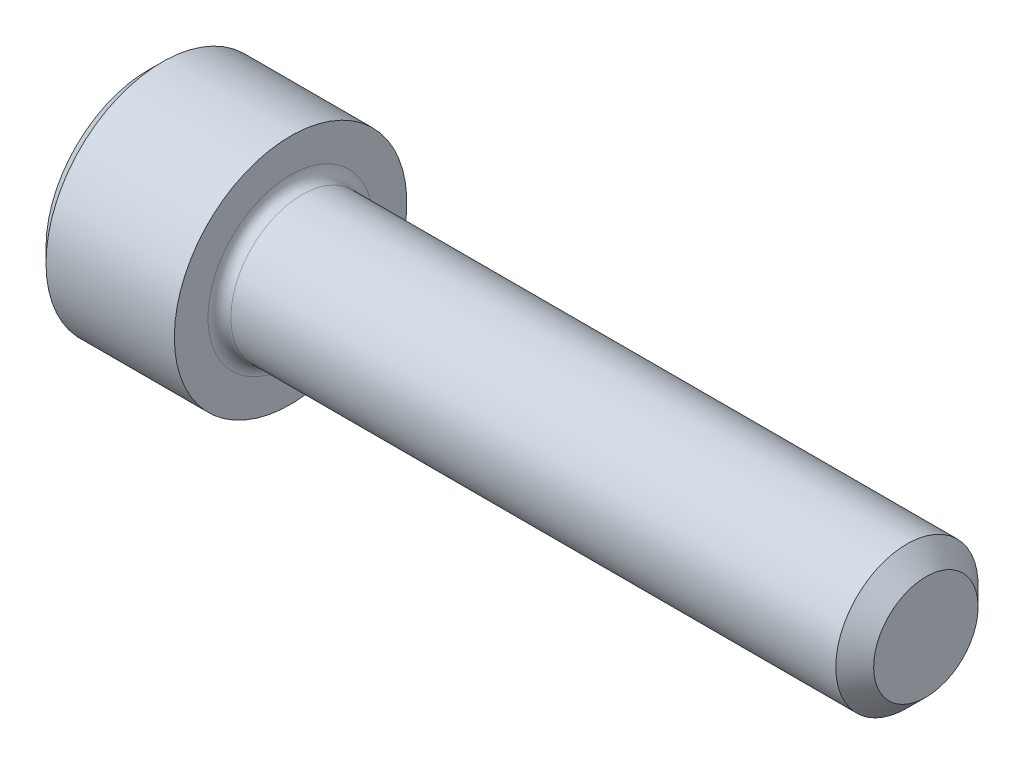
SolidWorks part; units mm, degrees
revolve "Base-Revolve" add sketch "BodySke"
sketch "BodySke" plane through (0, 0, 0) normal (0, 0, 1) x (1, 0, 0)
  line L0 (0, 0) -> (0, 2.0447)
  line L1 (0.2794, 2.3241) -> (2.8448, 2.3241)
  line L2 (2.8448, 2.3241) -> (2.8448, 1.4224)
  line L3 (2.8448, 1.4224) -> (15.1663, 1.4224)
  line L4 (15.5448, 1.0439) -> (15.5448, 0)
  line L5 (15.5448, 0) -> (0, 0)
  line L6 (-31.75, 0) -> (127, 0) construction
  line L7 (0, 2.0447) -> (0.2794, 2.3241)
  line L8 (15.5448, 1.0439) -> (15.1663, 1.4224)
  line L9 (0, -2.0447) -> (0.2794, -2.3241) construction
  line L10 (15.5448, -1.0439) -> (15.1663, -1.4224) construction
  line L11 (3.4798, 9.525) -> (3.4798, 3.175) construction
  line L12 (2.8448, 9.525) -> (2.8448, 3.175) construction
  line L13 (-22.5552, 9.525) -> (-22.5552, 3.175) construction
  dimension "Diameter" = 2.8448
  dimension "Head_ht" = 2.8448
  dimension "Length" = 12.7
  dimension "Body_ch_ang" = 45
  dimension "Head_dia" = 4.6482
  dimension "Head_ch_ang" = 45
  dimension "Head_side_ht" = 2.5654
  dimension "Minor_dia" = 2.0879
  dimension "Advance" = 0.635
  dimension "Thread_nom" = 12.7
  dimension "Thread_length" = 38.1
fillet "Fillet1" radius 0.2286 1 edges at (2.8448, 0, 1.4224)
ref_plane "Plane1" through (0, 0, 0) normal (0, 0, 1) x (1, 0, 0)
ref_plane "Plane2" through (0, 0, 0) normal (0, 1, 0) x (1, 0, 0)
ref_plane "Plane3" through (0, 0, 0) normal (1, 0, 0) x (0, 0, -1)
sketch "Sketch2" plane through (0, 0, 0) normal (0, 0, 1) x (1, 0, 0)
  line L0 (0, 1.1938) -> (1.2954, 1.1938)
  line L1 (1.2954, 1.1938) -> (1.9846, 0)
  line L2 (-31.75, 0) -> (127, 0) construction
  line L3 (1.9846, 0) -> (0, 0)
  line L4 (0, 0) -> (0, 1.1938)
  line L5 (0, 2.0447) -> (0, -2.0447) construction
  line L6 (0, 0) -> (47.625, 0) construction
  line L7 (2.8448, -2.3241) -> (2.8448, 2.3241) construction
revolve "Hex-PreBroach" cut sketch "Sketch2" angle 360 about L6
sketch "Sketch3" plane through (0, 0, 0) normal (-1, 0, 0) x (0, 0.5, 0.866)
  line L0 (0.6892, 1.1938) -> (-0.6892, 1.1938)
  line L1 (-0.6892, 1.1938) -> (-1.3785, 0)
  line L2 (0.6892, 1.1938) -> (1.3785, 0)
  line L3 (0.6892, -1.1938) -> (1.3785, 0)
  line L4 (0.6892, -1.1938) -> (-0.6892, -1.1938)
  line L5 (-0.6892, -1.1938) -> (-1.3785, 0)
extrude "Hex" cut sketch "Sketch3" against normal blind 1.2954
sketch "Sketch4" plane through (0, 0, 0) normal (-1, 0, 0) x (0, 0, 1)
  line L0 (0, 0) -> (1.4605, 0)
  line L1 (0, 0) -> (6.1484, 3.5498) construction
  line L2 (0, 0) -> (0.7302, 1.2648)
  line L3 (1.2009, 0.3267) -> (1.3933, 0.4378)
  line L4 (0.8834, 0.8767) -> (1.0758, 0.9877)
  arc A0 (1.2009, 0.3267) -> (0.8834, 0.8767) centre (0, 0) ccw
  arc A1 (1.4605, 0) -> (1.3933, 0.4378) centre (0, 0) ccw
  arc A2 (0.7302, 1.2648) -> (1.0758, 0.9877) centre (0, 0) cw
extrude "Spline" [suppressed] cut sketch "Sketch4" against normal blind 1.2954
pattern_circular "CirPattern1" [suppressed] count 6 every 60
sketch "Sketch5" plane through (0, 0, 0) normal (0, 0, 1) x (1, 0, 0)
  line L0 (-31.75, 0) -> (127, 0) construction
  line L2 (0, 2.0447) -> (0, -2.0447) construction
  circle A0 centre (1.016, 0) radius 0.4445
  dimension "Drilled_hole_dia" = 0.889
  dimension "Drilled_hole_loc" = 1.016
extrude "Hole" [suppressed] cut sketch "Sketch5" against normal through all and the other way through all
pattern_circular "Drilled-4" [suppressed] count 2 every 60
pattern_circular "Drilled-6" [suppressed] count 3 every 60
sketch "ThdSchSke" plane through (0, 0, 0) normal (0, 0, 1) x (1, 0, 0)
  line L0 (3.4798, -1.0439) -> (3.2148, -1.4224)
  line L1 (3.4798, -1.0439) -> (3.7448, -1.4224)
  line L2 (3.7448, -1.4224) -> (3.7448, -1.778)
  line L3 (-3.175, 0) -> (5.1513, 0) construction
  line L5 (3.7448, -1.778) -> (3.2148, -1.778)
  line L6 (3.2148, -1.778) -> (3.2148, -1.4224)
  line L7 (0, 2.0447) -> (0, -2.0447) construction
revolve "ThreadSchematic" [suppressed] cut sketch "ThdSchSke" angle 360 about L3
pattern_linear "ThdSchPat" [suppressed]
equation "\"D2@Sketch3\" = \"Hex_size@Sketch3\" / 2"
equation "\"D1@Sketch3\" = \"Hex_size@Sketch3\" / 2"
equation "\"D1@Sketch2\" = \"Hex_size@Sketch3\" / 2"
equation "\"D3@Sketch4\" = \"Spline_p_dim@Sketch4\" / 2"
equation "\"Thread_minor@ThreadCosmetic\"  =  \"Minor_dia@BodySke\""
equation "\"D2@CirPattern1\" = 360 / \"Num_teeth@CirPattern1\""
equation "\"Wall_thickness@Sketch2\" = \"Head_ht@BodySke\" - \"Key_eng@Hex\""
equation "\"Thread_length@ThreadCosmetic\" = ((sgn( (\"Length@BodySke\" - \"Advance@BodySke\" ) - \"Thread_nom@BodySke\" )-1)*( (\"Length@BodySke\" - \"Advance@BodySke\" ) - \"Thread_nom@BodySke\" ))/-2+ \"Thread_nom@BodySke\""
equation "\"Thread_minor@ThdSchSke\" = \"Minor_dia@BodySke\""
equation "\"Diameter@ThdSchSke\" = \"Diameter@BodySke\""
equation "\"Overcut@ThdSchSke\" = \"Diameter@BodySke\" * 1.25"
equation "\"Start@ThdSchSke\" = \"Head_ht@BodySke\" + \"Length@BodySke\" - \"Thread_length@ThreadCosmetic\"  '---Non-countersunk---"
equation "\"Num_threads@ThdSchPat\" = int( \"Thread_length@ThreadCosmetic\" / \"Advance@BodySke\" + 0.999 )  + 1"
equation "\"Advance@ThdSchPat\" = \"Thread_length@ThreadCosmetic\" /  (\"Num_threads@ThdSchPat\" - 1) 'relax it"
equation "\"Num_threads@ThdSchPat\" = \"Num_threads@ThdSchPat\" - sgn( \"Num_threads@ThdSchPat\" - 1) '---chamfered tips only---"
